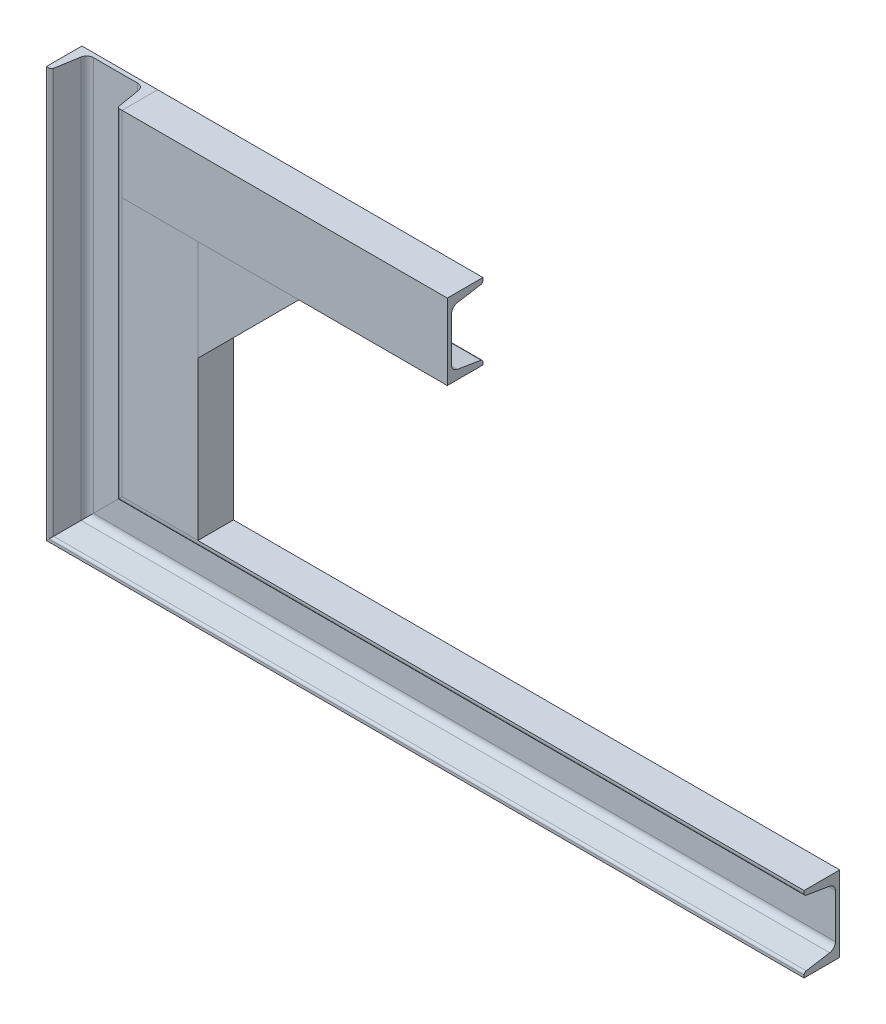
SolidWorks part; units mm, degrees
ref_plane "Front Plane" through (0, 0, 0) normal (0, 0, 1) x (1, 0, 0)
ref_plane "Top Plane" through (0, 0, 0) normal (0, 1, 0) x (1, 0, 0)
ref_plane "Right Plane" through (0, 0, 0) normal (1, 0, 0) x (0, 0, -1)
sketch "Sketch1" plane through (0, 0, 0) normal (0, 0, 1) x (1, 0, 0)
  line L0 (850.8092, 58.9632) -> (523.7842, 58.9632)
  line L1 (523.7842, 58.9632) -> (523.7842, -277.5868)
  line L2 (523.7842, -277.5868) -> (1209.5842, -277.5868)
  dimension "D1" = 327.025
  dimension "D2" = 336.55
  dimension "D4" = 685.8
other "Structural Member2"
ref_plane "Plane2" through (850.8092, 58.9632, 0) normal (-1, 0, 0) x (0, -1, 0)
sketch "Sketch15" plane through (850.8092, 58.9632, 0) normal (-1, 0, 0) x (0, 0, -1)
  line L0 (0, 0) -> (0, 76.2)
  line L1 (0, 76.2) -> (35.814, 76.2)
  line L2 (0, 0) -> (35.814, 0)
  line L5 (0, 38.1) -> (4.318, 38.1) construction
  line L12 (4.318, 60.325) -> (4.318, 15.875)
  line L15 (35.814, 76.2) -> (35.814, 73.5359)
  line L16 (35.814, 0) -> (35.814, 2.6641)
  line L17 (10.0485, 67.0897) -> (33.6916, 71.0305)
  line L18 (10.0485, 9.1103) -> (33.6916, 5.1695)
  arc A9 (4.318, 15.875) -> (10.0485, 9.1103) centre (11.176, 15.875) ccw
  arc A10 (4.318, 60.325) -> (10.0485, 67.0897) centre (11.176, 60.325) cw
  arc A11 (35.814, 73.5359) -> (33.6916, 71.0305) centre (33.274, 73.5359) cw
  arc A12 (35.814, 2.6641) -> (33.6916, 5.1695) centre (33.274, 2.6641) ccw
  point P4 (17.907, 76.2)
  point P5 (17.907, 0)
  point P8 (0, 0)
  dimension "RI" = 6.858
  dimension "D2" = 9.463
  dimension "RA" = 2.54
  dimension "DEPTH" = 76.2
  dimension "BF" = 35.814
  dimension "TW" = 4.318
  dimension "d1" = 44.45
other "Structural Member4"
ref_plane "Plane4" through (547.5378, 63.4979, 0) normal (0, -1, 0) x (1, 0, 0)
sketch "Sketch17" plane through (471.3378, 63.4979, 0) normal (0, -1, 0) x (0, 0, -1)
  line L0 (0, 0) -> (0, 76.2)
  line L1 (0, 76.2) -> (35.814, 76.2)
  line L2 (0, 0) -> (35.814, 0)
  line L5 (0, 38.1) -> (4.318, 38.1) construction
  line L12 (4.318, 60.325) -> (4.318, 15.875)
  line L15 (35.814, 76.2) -> (35.814, 73.5359)
  line L16 (35.814, 0) -> (35.814, 2.6641)
  line L17 (10.0485, 67.0897) -> (33.6916, 71.0305)
  line L18 (10.0485, 9.1103) -> (33.6916, 5.1695)
  arc A9 (4.318, 15.875) -> (10.0485, 9.1103) centre (11.176, 15.875) ccw
  arc A10 (4.318, 60.325) -> (10.0485, 67.0897) centre (11.176, 60.325) cw
  arc A11 (35.814, 73.5359) -> (33.6916, 71.0305) centre (33.274, 73.5359) cw
  arc A12 (35.814, 2.6641) -> (33.6916, 5.1695) centre (33.274, 2.6641) ccw
  point P4 (17.907, 76.2)
  point P5 (17.907, 0)
  point P8 (0, 0)
  dimension "RI" = 6.858
  dimension "D2" = 9.463
  dimension "RA" = 2.54
  dimension "DEPTH" = 76.2
  dimension "BF" = 35.814
  dimension "TW" = 4.318
  dimension "d1" = 44.45
other "Structural Member5"
ref_plane "Plane7" through (547.5378, 63.4979, 0) normal (0, -1, 0) x (1, 0, 0)
sketch "Sketch111" plane through (471.3378, 63.4979, 0) normal (0, -1, 0) x (0, 0, -1)
  line L0 (0, 0) -> (0, 76.2)
  line L1 (0, 76.2) -> (35.814, 76.2)
  line L2 (0, 0) -> (35.814, 0)
  line L5 (0, 38.1) -> (4.318, 38.1) construction
  line L12 (4.318, 60.325) -> (4.318, 15.875)
  line L15 (35.814, 76.2) -> (35.814, 73.5359)
  line L16 (35.814, 0) -> (35.814, 2.6641)
  line L17 (10.0485, 67.0897) -> (33.6916, 71.0305)
  line L18 (10.0485, 9.1103) -> (33.6916, 5.1695)
  arc A9 (4.318, 15.875) -> (10.0485, 9.1103) centre (11.176, 15.875) ccw
  arc A10 (4.318, 60.325) -> (10.0485, 67.0897) centre (11.176, 60.325) cw
  arc A11 (35.814, 73.5359) -> (33.6916, 71.0305) centre (33.274, 73.5359) cw
  arc A12 (35.814, 2.6641) -> (33.6916, 5.1695) centre (33.274, 2.6641) ccw
  point P4 (17.907, 76.2)
  point P5 (17.907, 0)
  point P8 (0, 0)
  dimension "RI" = 6.858
  dimension "D2" = 9.463
  dimension "RA" = 2.54
  dimension "DEPTH" = 76.2
  dimension "BF" = 35.814
  dimension "TW" = 4.318
  dimension "d1" = 44.45
other "Structural Member6"
ref_plane "Plane8" through (523.7842, -277.5868, 0) normal (1, 0, 0) x (0, 1, 0)
sketch "Sketch115" plane through (523.7842, -277.5868, -35.814) normal (1, 0, 0) x (0, 0, 1)
  line L0 (0, 0) -> (0, 76.2)
  line L1 (0, 76.2) -> (35.814, 76.2)
  line L2 (0, 0) -> (35.814, 0)
  line L5 (0, 38.1) -> (4.318, 38.1) construction
  line L12 (4.318, 60.325) -> (4.318, 15.875)
  line L15 (35.814, 76.2) -> (35.814, 73.5359)
  line L16 (35.814, 0) -> (35.814, 2.6641)
  line L17 (10.0485, 67.0897) -> (33.6916, 71.0305)
  line L18 (10.0485, 9.1103) -> (33.6916, 5.1695)
  arc A9 (4.318, 15.875) -> (10.0485, 9.1103) centre (11.176, 15.875) ccw
  arc A10 (4.318, 60.325) -> (10.0485, 67.0897) centre (11.176, 60.325) cw
  arc A11 (35.814, 73.5359) -> (33.6916, 71.0305) centre (33.274, 73.5359) cw
  arc A12 (35.814, 2.6641) -> (33.6916, 5.1695) centre (33.274, 2.6641) ccw
  point P4 (17.907, 76.2)
  point P5 (17.907, 0)
  point P8 (0, 0)
  dimension "RI" = 6.858
  dimension "D2" = 9.463
  dimension "RA" = 2.54
  dimension "DEPTH" = 76.2
  dimension "BF" = 35.814
  dimension "TW" = 4.318
  dimension "d1" = 44.45
sketch "Sketch24" plane through (850.8092, 0, 0) normal (1, 0, 0) x (0, 0, -1)
  circle A0 centre (144.6108, 20.8632) radius 114.3
  arc A5 (35.814, -14.5727) -> (33.6916, -12.0673) centre (33.274, -14.5727) ccw construction
  arc A6 (33.6916, 53.7937) -> (35.814, 56.2991) centre (33.274, 56.2991) ccw construction
extrude "Extrude8" [suppressed] cut sketch "Sketch24" against normal through all
other "Gusset3" parameters "D1"=6.35, "D2"=6.35, "D3"=0, "D4"=0, "D10"=6.35, "D11"=101.6, "D12"=101.6, "D13"=12.7, "D14"=45, "D15"=12.7
sketch "Sketch27" plane through (599.9842, -17.2368, -35.814) normal (0, 0, 1) x (1, 0, 0)
  line L0 (0, 0) -> (0, -101.6)
  line L1 (0, 0) -> (101.6, 0)
  line L2 (0, -101.6) -> (101.6, 0)
other "Gusset4" parameters "D1"=6.35, "D2"=6.35, "D3"=0, "D4"=0, "D10"=6.35, "D11"=101.6, "D12"=101.6, "D13"=12.7, "D14"=45, "D15"=12.7
sketch "Sketch28" plane through (599.9842, -17.2368, 0) normal (0, 0, -1) x (-1, 0, 0)
  line L0 (0, 0) -> (-101.6, 0)
  line L1 (0, 0) -> (0, -101.6)
  line L2 (-101.6, 0) -> (0, -101.6)
